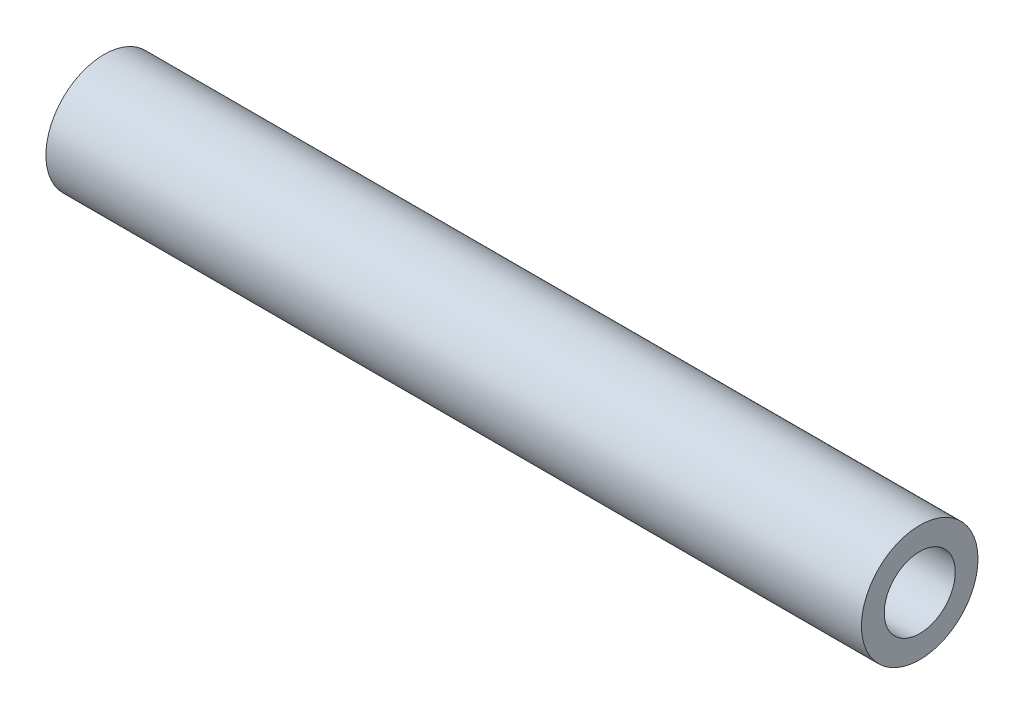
SolidWorks part; units mm, degrees
ref_plane "Front Plane" through (0, 0, 0) normal (0, 0, 1) x (1, 0, 0)
ref_plane "Top Plane" through (0, 0, 0) normal (0, 1, 0) x (1, 0, 0)
ref_plane "Right Plane" through (0, 0, 0) normal (1, 0, 0) x (0, 0, -1)
sketch "Sketch1" plane through (0, 0, 0) normal (1, 0, 0) x (0, 0, -1)
  circle A0 centre (0, 0) radius 3.05
  circle A1 centre (0, 0) radius 5
  dimension "D1" = 10
  dimension "D2" = 6.1
extrude "Boss-Extrude1" add sketch "Sketch1" along normal blind 70
